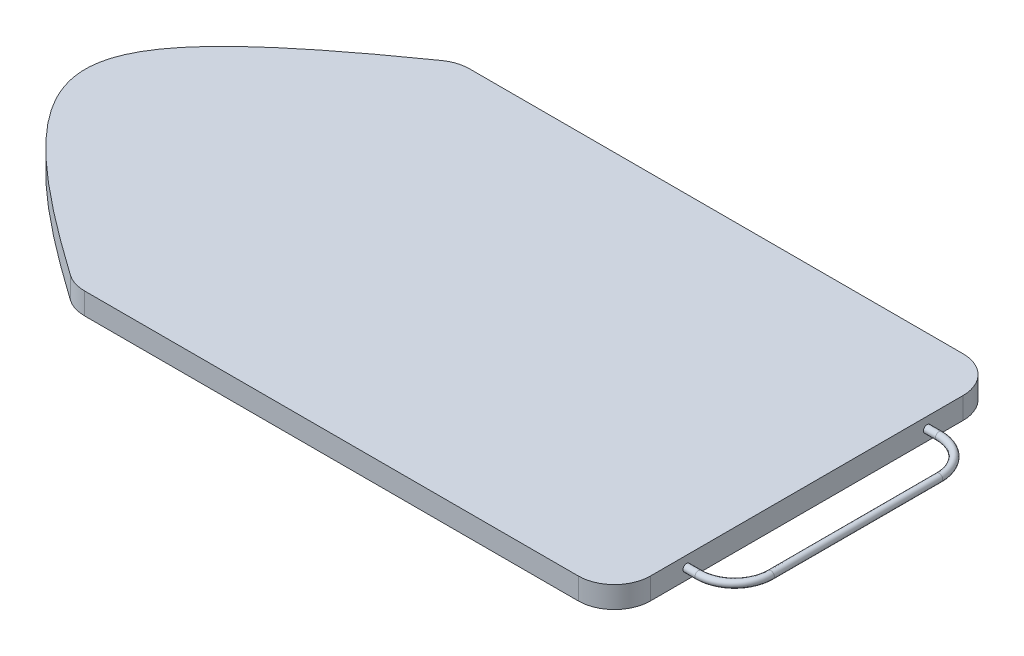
SolidWorks part; units mm, degrees
ref_plane "Front Plane" through (0, 0, 0) normal (0, 0, 1) x (1, 0, 0)
ref_plane "Top Plane" through (0, 0, 0) normal (0, 1, 0) x (1, 0, 0)
ref_plane "Right Plane" through (0, 0, 0) normal (1, 0, 0) x (0, 0, -1)
body saved out of another part "Stock-Ironing Board 2-1"
sketch "Sketch1" plane through (0, 0, 0) normal (0, 0, 1) x (1, 0, 0)
  line L0 (-402.9781, -18.5661) -> (-276.9347, -18.5661)
  line L1 (-141.3866, -51.4648) -> (-133.9425, -50.5508)
  line L2 (-138.0861, -16.8042) -> (-145.5302, -17.7182)
  line L3 (-208.1166, -16.5561) -> (-215.5607, -17.4701)
  line L4 (-211.4171, -51.2167) -> (-203.973, -50.3026)
  line L5 (-208.0556, -17.0523) -> (-215.4997, -17.9664)
  arc A0 (-276.9347, -18.5661) -> (-243.6306, -36.4113) centre (-276.9347, -58.5661) cw
  arc A1 (-133.9425, -50.5508) -> (-119.141, -31.6057) centre (-136.0143, -33.6775) ccw
  arc A2 (-119.141, -31.6057) -> (-138.0861, -16.8042) centre (-136.0143, -33.6775) ccw
  arc A3 (-188.8929, -31.5752) -> (-208.1166, -16.5561) centre (-206.0143, -33.6775) ccw
  arc A4 (-215.5607, -17.4701) -> (-215.4997, -17.9664) centre (-215.5302, -17.7182) ccw
  arc A5 (-243.6306, -36.4113) -> (-211.4171, -51.2167) centre (-215.5302, -17.7182) ccw
  arc A6 (-203.973, -50.3026) -> (-189.3892, -31.6362) centre (-206.0143, -33.6775) ccw
  arc A7 (-189.3892, -31.6362) -> (-208.0556, -17.0523) centre (-206.0143, -33.6775) ccw
  spline S0 degree 3 poles (-188.8929, -31.5752) (-187.2943, -44.5951) (-154.1237, -53.0287) (-141.3866, -51.4648) knots 0 0 0 0 1 1 1 1
  dimension "D1" = 40
  dimension "D2" = 17
  dimension "D3" = 17.25
  dimension "D4" = 0.25
  dimension "D5" = 119.141
  dimension "D6" = 133.9425
  dimension "D7" = 136.0143
  dimension "D8" = 138.0861
  dimension "D9" = 141.3866
  dimension "D10" = 203.973
  dimension "D11" = 188.8929
  dimension "D12" = 189.3892
  dimension "D13" = 243.6306
  dimension "D14" = 16.5561
  dimension "D23" = 402.9781
